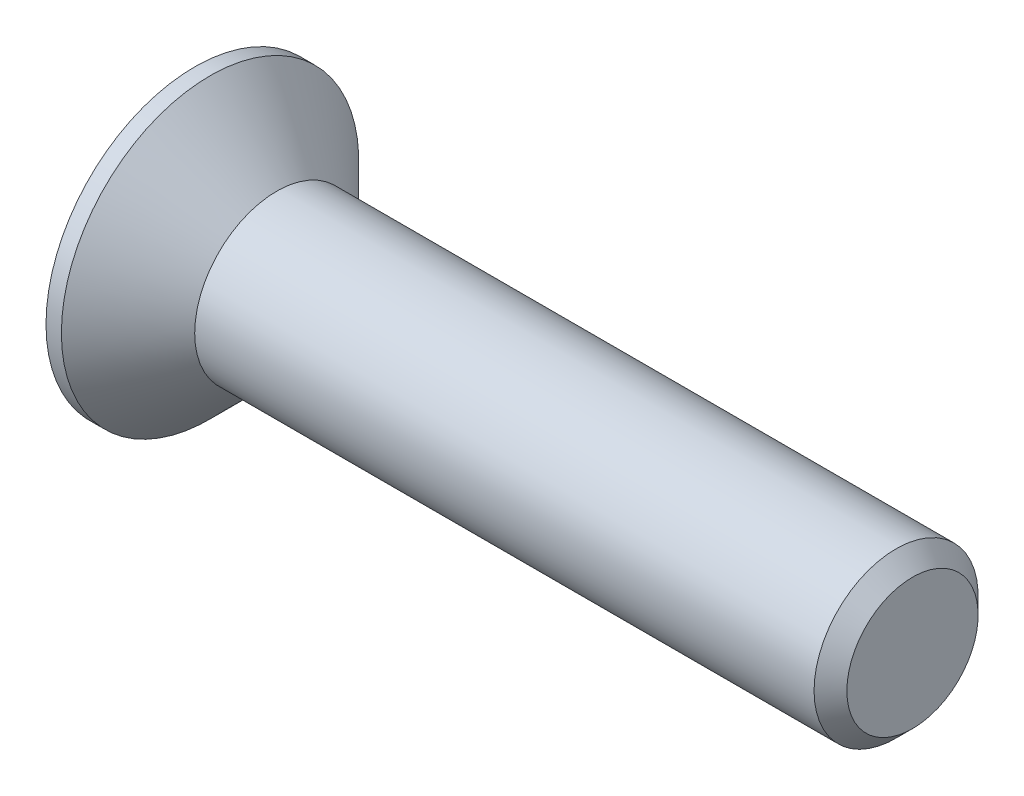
SolidWorks part; units mm, degrees
ref_plane "Front Plane" through (0, 0, 0) normal (0, 0, 1) x (1, 0, 0)
ref_plane "Top Plane" through (0, 0, 0) normal (0, 1, 0) x (1, 0, 0)
ref_plane "Right Plane" through (0, 0, 0) normal (1, 0, 0) x (0, 0, -1)
sketch "Sketch1" plane through (0, 0, 0) normal (0, 0, 1) x (1, 0, 0)
  line L1 (-4, 7.25) -> (-4, 0)
  line L2 (-4, 0) -> (31, 0)
  line L3 (31, 0) -> (31, 4)
  line L4 (31, 4) -> (0, 4)
  line L5 (-4, 7.25) -> (-3.25, 7.25)
  line L6 (-3.25, 7.25) -> (0, 4)
  dimension "D1" = 4
  dimension "D2" = 45
  dimension "D3" = 4
  dimension "D4" = 35
  dimension "D5" = 7.25
revolve "Revolve1" add sketch "Sketch1" angle 360 about L2
chamfer "Chamfer1" distance 0.8 angle 45 1 edges at (31, 0, 4)
sketch "Sketch2" plane through (-4, 0, 0) normal (-1, 0, 0) x (0, 0, 1)
  line L0 (-1.09, 4.35) -> (1.09, 4.35)
  line L1 (1.09, 4.35) -> (1.09, 1.09)
  line L2 (1.09, 1.09) -> (4.35, 1.09)
  line L3 (4.35, 1.09) -> (4.35, -1.09)
  line L4 (4.35, -1.09) -> (1.09, -1.09)
  line L5 (1.09, -1.09) -> (1.09, -4.35)
  line L6 (1.09, -4.35) -> (-1.09, -4.35)
  line L7 (-1.09, -4.35) -> (-1.09, -1.09)
  line L8 (-1.09, -1.09) -> (-4.35, -1.09)
  line L9 (-4.35, -1.09) -> (-4.35, 1.09)
  line L10 (-4.35, 1.09) -> (-1.09, 1.09)
  line L11 (-1.09, 1.09) -> (-1.09, 4.35)
  point P2 (0, 4.35)
  point P14 (0, -4.35)
  point P15 (4.35, 0)
  point P16 (-4.35, 0)
  dimension "D1" = 8.7
  dimension "D2" = 2.18
extrude "Cut-Extrude1" cut sketch "Sketch2" against normal blind 3.45
